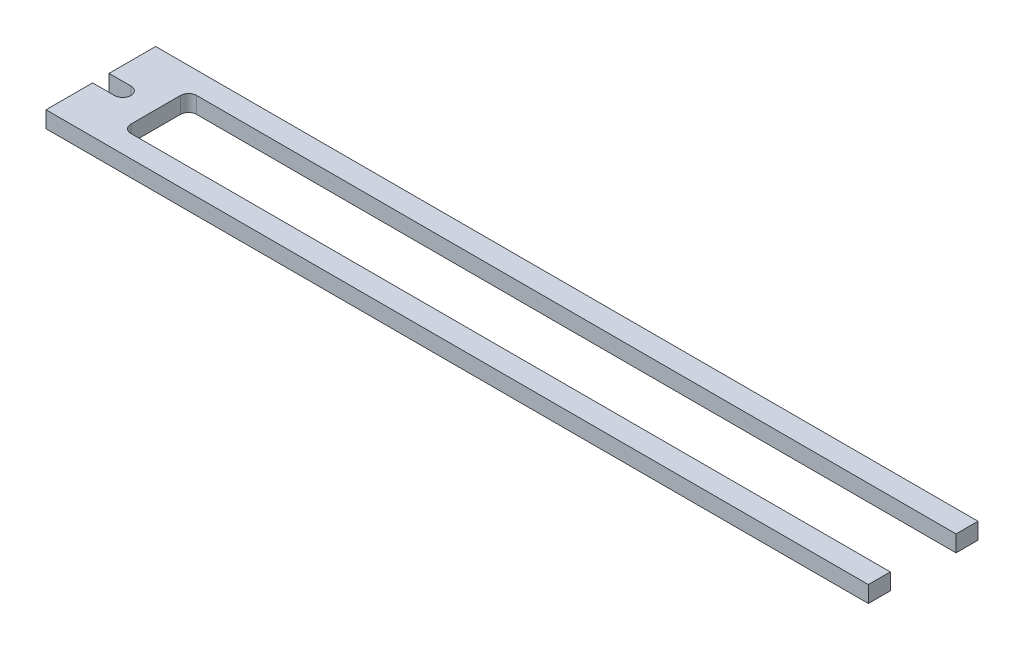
SolidWorks part; units mm, degrees
ref_plane "Спереди" through (0, 0, 0) normal (0, 0, 1) x (1, 0, 0)
ref_plane "Сверху" through (0, 0, 0) normal (0, 1, 0) x (1, 0, 0)
ref_plane "Справа" through (0, 0, 0) normal (1, 0, 0) x (0, 0, -1)
sketch "Эскиз1" plane through (0, 0, 0) normal (0, 1, 0) x (1, 0, 0)
  line L0 (51.9857, 3.75) -> (-17.2743, 3.75)
  line L1 (-23.0143, 5.75) -> (51.9857, 5.75)
  line L2 (-23.0143, 5.75) -> (-23.0143, 1.5)
  line L3 (-23.0143, -4.25) -> (51.9857, -4.25)
  line L4 (51.9857, 5.75) -> (51.9857, 3.75)
  line L5 (51.9857, -2.25) -> (-17.2743, -2.25)
  line L6 (-18.0143, 3.01) -> (-18.0143, -1.51)
  line L7 (51.9857, -2.25) -> (51.9857, -4.25)
  line L9 (-23.0143, 1.5) -> (-21.0143, 1.5)
  line L11 (-21.0143, 0) -> (-23.0143, 0)
  line L12 (-23.0143, 0) -> (-23.0143, -4.25)
  arc A0 (-21.0143, 1.5) -> (-21.0143, 0) centre (-21.0143, 0.75) cw
  arc A2 (-17.2743, -2.25) -> (-18.0143, -1.51) centre (-17.2743, -1.51) cw
  arc A3 (-17.2743, 3.75) -> (-18.0143, 3.01) centre (-17.2743, 3.01) ccw
  point P12 (-20.2743, 0)
  point P18 (-20.2743, 1.5)
  dimension "D9" = 2
  dimension "D1" = 10
  dimension "D2" = 75
  dimension "D3" = 2
  dimension "D4" = 2
  dimension "D5" = 5
  dimension "D6" = 1.5
  dimension "D7" = 4.25
  dimension "D8" = 4.25
extrude "Бобышка-Вытянуть1" add sketch "Эскиз1" along normal blind 1.5
